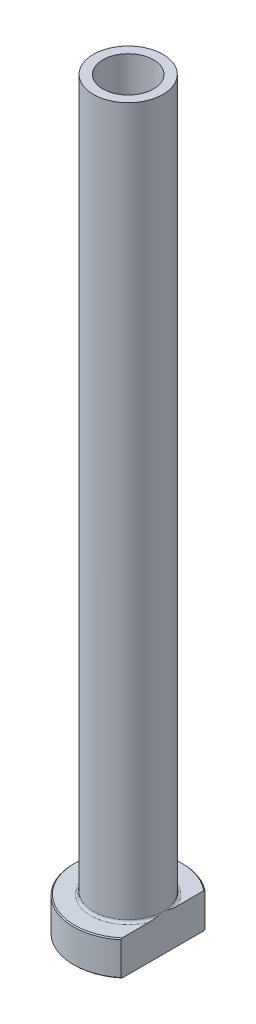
SolidWorks part; units mm, degrees
ref_plane "Front Plane" through (0, 0, 0) normal (0, 0, 1) x (1, 0, 0)
ref_plane "Top Plane" through (0, 0, 0) normal (0, 1, 0) x (1, 0, 0)
ref_plane "Right Plane" through (0, 0, 0) normal (1, 0, 0) x (0, 0, -1)
sketch "Sketch1" plane through (0, 0, 0) normal (0, 0, 1) x (1, 0, 0)
  line L0 (-5.1, 150) -> (-7, 150)
  line L1 (-7, 150) -> (-7, 7)
  line L2 (-7, 7) -> (-11, 7)
  line L3 (-11, 7) -> (-11, 0)
  line L4 (9.9, 0) -> (-9.9, 0) construction
  line L5 (-11, 0) -> (-5.35, 0)
  line L6 (-5.1, 95) -> (-5.1, 150)
  line L7 (0, 92.1877) -> (0, -15.5353) construction
  line L8 (0, -12.1) -> (0, 12.1) construction
  line L9 (-5.1, 95) -> (-5.35, 83)
  line L10 (-5.35, 83) -> (-5.35, 0)
  dimension "D1" = 0.25
  dimension "ID" = 10.2
  dimension "OD" = 14
  dimension "L" = 150
  dimension "H" = 22
  dimension "T" = 7
  dimension "N" = 55
  dimension "D2" = 12
  dimension "L-N" = 95
revolve "Revolve1" add sketch "Sketch1" angle 360 about L7
fillet "Fillet1" radius 0.5 1 edges at (0, 7, 7)
chamfer "Chamfer1" distance 0.2 angle 45 2 edges at (0, 7, 11) (0, 0, 11)
sketch "Sketch2" plane through (0, 0, 0) normal (0, -1, 0) x (1, 0, 0)
  line L0 (7, 8.4853) -> (7, -8.4853)
  circle A0 centre (0, 0) radius 11 construction
  arc A1 (7, 8.4853) -> (7, -8.4853) centre (0, 0) cw
  circle A2 centre (0, 0) radius 7 construction
extrude "Cut-Extrude1" cut sketch "Sketch2" against normal through all
chamfer "Chamfer2" distance 0.5 angle 45 1 edges at (0, 0, 5.35)
